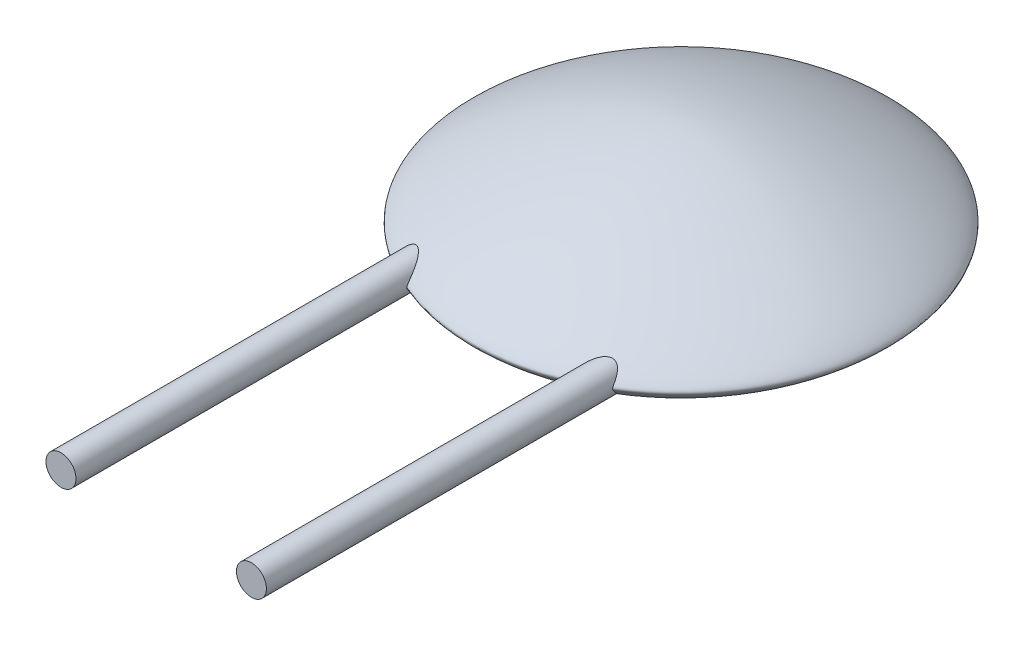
SolidWorks part; units mm, degrees
ref_plane "Plan de face" through (0, 0, 0) normal (0, 0, 1) x (1, 0, 0)
ref_plane "Plan de dessus" through (0, 0, 0) normal (0, 1, 0) x (1, 0, 0)
ref_plane "Plan de droite" through (0, 0, 0) normal (1, 0, 0) x (0, 0, -1)
sketch "Esquisse1" plane through (0, 0, 0) normal (0, 0, 1) x (1, 0, 0)
  line L4 (0, 1.05) -> (0, -1.05)
  spline S0 degree 3 poles (0, 1.05) (-1.1725, 1.05) (-2.8, 0.1619) (-2.8, -0.1619) (-1.2957, -1.05) (0, -1.05) knots 0 0 0 0 0.5 0.5 1 1 1 1
  dimension "D1" = 2.1
revolve "Révolution1" add sketch "Esquisse1" angle 360 about L4
ref_plane "Plan1" through (0, 0, 3) normal (0, 0, 1) x (1, 0, 0)
sketch "Esquisse2" plane through (0, 0, 3) normal (0, 0, 1) x (1, 0, 0)
  circle A0 centre (-1.27, 0) radius 0.2
  circle A1 centre (1.27, 0) radius 0.2
  dimension "D1" = 1.27
  dimension "D2" = 1.27
extrude "Extrusion1" add sketch "Esquisse2" against normal up to next
ref_plane "Plan3" through (0, 0, 0) normal (1, 0, 0) x (0, 0, -1)
sketch "Esquisse3" plane through (0, 0, 3) normal (0, 0, 1) x (1, 0, 0)
  circle A0 centre (-1.27, 0) radius 0.2
  circle A1 centre (1.27, 0) radius 0.2
extrude "Boss.-Extru.1" add sketch "Esquisse3" along normal blind 4
